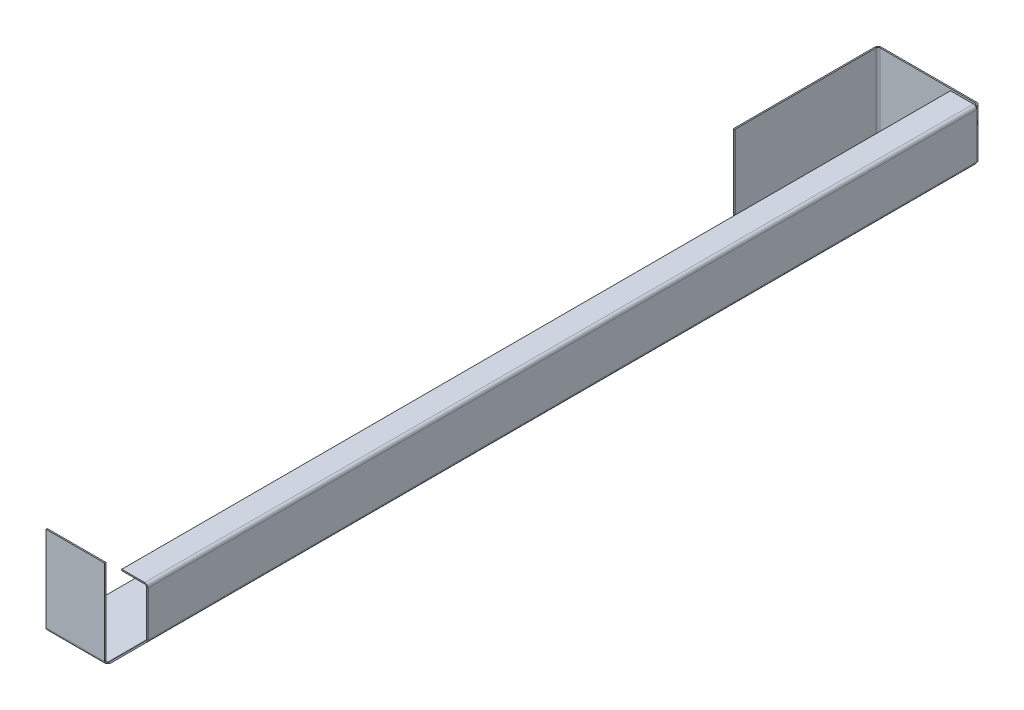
SolidWorks part; units mm, degrees
ref_plane "Face" through (0, 0, 0) normal (0, 0, 1) x (1, 0, 0)
ref_plane "Dessus" through (0, 0, 0) normal (0, 1, 0) x (1, 0, 0)
ref_plane "Droite" through (0, 0, 0) normal (1, 0, 0) x (0, 0, -1)
mirrored part "carter coté_Rendre symétrique"
other "<carter coté>-<Tôle pliée sur arête10>"
